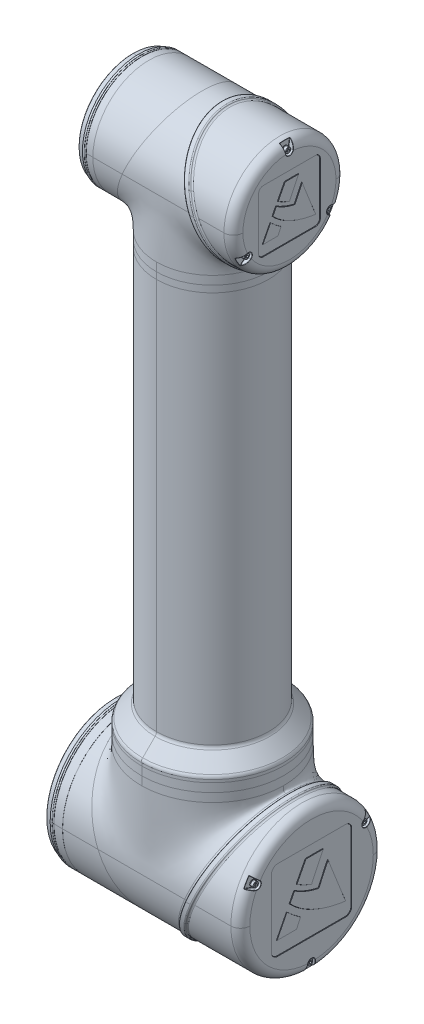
SolidWorks part; units mm, degrees
ref_plane "前视基准面" through (0, 0, 0) normal (0, 0, 1) x (1, 0, 0)
ref_plane "上视基准面" through (0, 0, 0) normal (0, 1, 0) x (1, 0, 0)
ref_plane "右视基准面" through (0, 0, 0) normal (1, 0, 0) x (0, 0, -1)
imported_body "输入1"
chamfer "倒角1" distance 0.5 angle 45
ref_plane "基准面1" through (264.1966, 0, 0) normal (-1, 0, 0) x (0, 0, 1)
ref_plane "基准面2" through (255.0366, 0, 0) normal (-1, 0, 0) x (0, 0, 1)
split "分割1" trim tools "基准面2", "基准面1" bodies to split 106 resulting bodies 107 108
move or copy body "实体-移动/复制1" bodies to move or copy 107 placed by mates yes
combine bodies "组合1" operation type add bodies to combine 108 109
ref_plane "基准面3" through (0, 297.9289, 0) normal (0, 1, 0) x (1, 0, 0)
ref_plane "基准面4" through (0, 294.9989, 0) normal (0, 1, 0) x (1, 0, 0)
ref_plane "基准面5" through (0, 285.9989, 0) normal (0, 1, 0) x (1, 0, 0)
ref_plane "基准面6" through (-0.0001, 746.5, -0.0001) normal (0, 1, 0) x (1, 0, 0)
ref_plane "基准面7" through (-0.0001, 737.5, -0.0001) normal (0, 1, 0) x (1, 0, 0)
ref_plane "基准面8" through (-0.0001, 730.5, -0.0001) normal (0, 1, 0) x (1, 0, 0)
ref_plane "基准面9" through (117, 0, 0) normal (-1, 0, 0) x (0, 0, 1)
ref_plane "基准面10" through (92, 0, 0) normal (-1, 0, 0) x (0, 0, 1)
ref_plane "基准面11" through (101, 0, 0) normal (1, 0, 0) x (0, 0, -1)
ref_plane "基准面12" through (126.327, -53.6226, 0) normal (-0.9205, 0.3907, 0) x (0, 0, 1)
split "分割2" trim tools "基准面12", "基准面10", "基准面11" bodies to split 113 resulting bodies 114 115 116 117 118
combine bodies "组合2" operation type add bodies to combine 117 118
split "分割3" trim tools "基准面4", "基准面5" bodies to split 119 resulting bodies 120 121 122
split "分割4" trim tools "基准面7", "基准面8" bodies to split 121 resulting bodies 123 124 125
ref_plane "基准面13" through (110, 0, 0) normal (-1, 0, 0) x (0, 0, 1)
ref_plane "基准面14" through (477.3349, 202.6166, 0) normal (-0.9205, -0.3907, 0) x (0, 0, 1)
split "分割5" trim tools "基准面14", "基准面13", "基准面9" bodies to split 124 resulting bodies 126 127 128 129
